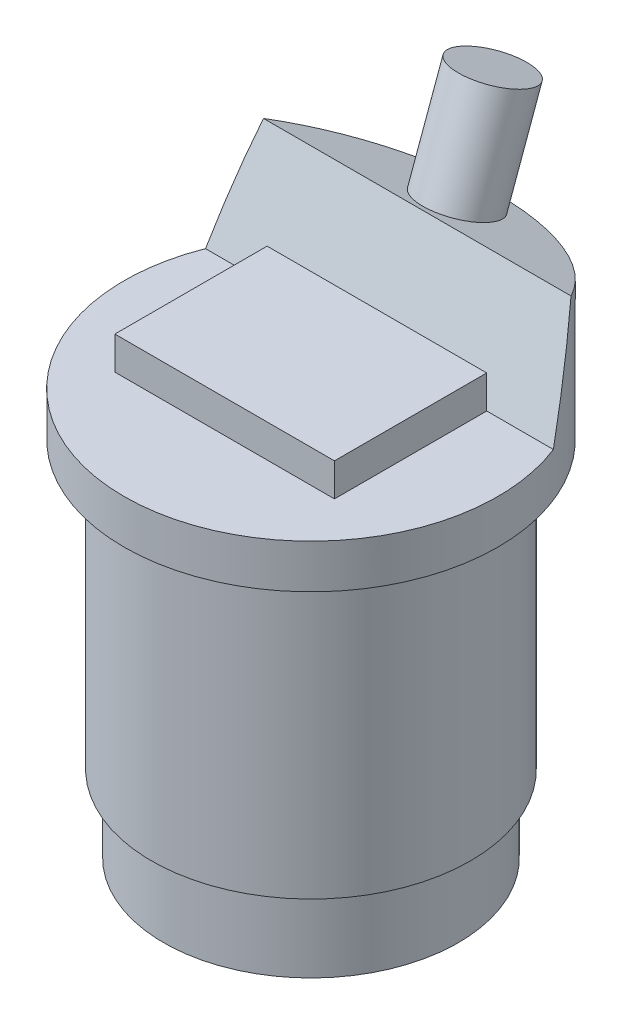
SolidWorks part; units mm, degrees
ref_plane "Front" through (0, 0, 0) normal (0, 0, 1) x (1, 0, 0)
ref_plane "Top" through (0, 0, 0) normal (0, 1, 0) x (1, 0, 0)
ref_plane "Right" through (0, 0, 0) normal (1, 0, 0) x (0, 0, -1)
sketch "Sketch1" plane through (0, 0, 0) normal (0, 1, 0) x (1, 0, 0)
  circle A0 centre (0, 0) radius 16.9926
  dimension "D1" = 33.9852
extrude "Extrude1" add sketch "Sketch1" against normal blind 3.9878
sketch "Sketch2" plane through (0, -3.9878, 0) normal (0, -1, 0) x (1, 0, 0)
  circle A0 centre (0, 0) radius 14.4907
  dimension "D1" = 28.9814
extrude "Extrude2" add sketch "Sketch2" along normal blind 25.9588
sketch "Sketch3" plane through (0, -29.9466, 0) normal (0, -1, 0) x (1, 0, 0)
  circle A0 centre (0, 0) radius 13.3985
  dimension "D1" = 26.797
extrude "Extrude3" add sketch "Sketch3" along normal blind 6.985
sketch "Sketch4" plane through (0, -3.9878, 0) normal (0, -1, 0) x (1, 0, 0)
  line L1 (-19.458, 16.8867) -> (-13.5001, 16.8867)
  line L2 (-19.458, 16.8867) -> (-19.458, -17.5687)
  line L3 (-19.458, -17.5687) -> (-13.5001, -17.5687)
  line L4 (-13.5001, 16.8867) -> (-13.5001, -17.5687)
  circle A0 centre (0, 0) radius 14.4907 construction
  dimension "D1" = 27.9908
extrude "Extrude4" cut sketch "Sketch4" along normal through all
sketch "Sketch5" plane through (0, 0, 0) normal (0, 1, 0) x (1, 0, 0)
  line L2 (9.7536, 6.223) -> (-10.2108, 6.223)
  line L3 (9.7536, 6.223) -> (9.7536, -7.62)
  line L4 (9.7536, -7.62) -> (-10.2108, -7.62)
  line L5 (-10.2108, 6.223) -> (-10.2108, -7.62)
  circle A0 centre (0, 0) radius 16.9926 construction
  circle A1 centre (0, 0) radius 16.9926 construction
  dimension "D1" = 9.3726
  dimension "D2" = 7.239
  dimension "D3" = 6.7818
  dimension "D4" = 19.9644
  dimension "D5" = 13.843
extrude "Extrude5" add sketch "Sketch5" along normal blind 2.9972
sketch "Sketch6" plane through (0, 0, 0) normal (0, 1, 0) x (1, 0, 0)
  line L0 (9.7536, 6.223) -> (-10.2108, 6.223) construction
  line L1 (15.8121, 6.223) -> (-15.8121, 6.223)
  circle A0 centre (0, 0) radius 16.9926 construction
  arc A1 (15.8121, 6.223) -> (-15.8121, 6.223) centre (0, 0) ccw
extrude "Extrude6" add sketch "Sketch6" along normal blind 9.4488
sketch "Sketch7" plane through (0, 0, 0) normal (1, 0, 0) x (0, 0, -1)
  line L0 (6.223, 0) -> (9.6621, 9.4488)
  line L1 (6.223, 9.4488) -> (6.223, 0) construction
  line L2 (-7.62, 0) -> (6.223, 0) construction
  line L3 (16.9926, 9.4488) -> (6.223, 9.4488) construction
  line L5 (6.223, 15.2199) -> (6.223, 0)
  line L6 (9.6621, 9.4488) -> (19.7643, 5.7719)
  line L7 (19.7643, 5.7719) -> (19.7643, 15.2199)
  line L8 (19.7643, 15.2199) -> (6.223, 15.2199)
  dimension "D1" = 20
extrude "Extrude7" cut sketch "Sketch7" against normal through all and the other way through all
sketch "Sketch9" plane through (0, 11.4488, -4.167) normal (0, 0.9397, -0.342) x (1, 0, 0)
  circle A0 centre (0, 9.6996) radius 3.302
  dimension "D1" = 6.604
  dimension "D2" = 9.6996
extrude "Extrude8" add sketch "Sketch9" along normal blind 9.4488
